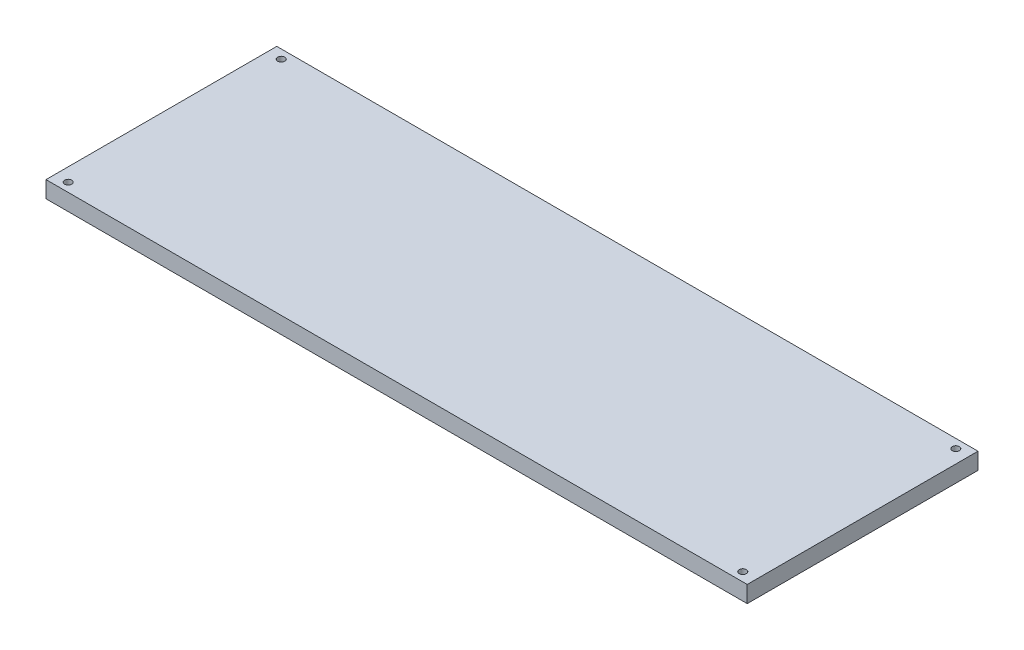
SolidWorks part; units mm, degrees
ref_plane "Front Plane" through (0, 0, 0) normal (0, 0, 1) x (1, 0, 0)
ref_plane "Top Plane" through (0, 0, 0) normal (0, 1, 0) x (1, 0, 0)
ref_plane "Right Plane" through (0, 0, 0) normal (1, 0, 0) x (0, 0, -1)
sketch "Sketch1" plane through (0, 0, 0) normal (0, 1, 0) x (1, 0, 0)
  line L1 (-250.825, -82.55) -> (250.825, -82.55)
  line L2 (-250.825, -82.55) -> (-250.825, 82.55)
  line L3 (-250.825, 82.55) -> (250.825, 82.55)
  line L4 (250.825, -82.55) -> (250.825, 82.55)
  line L5 (-250.825, -82.55) -> (250.825, 82.55) construction
  line L6 (-250.825, 82.55) -> (250.825, -82.55) construction
  point P0 (0, 0)
  dimension "D1" = 501.65
  dimension "D2" = 165.1
extrude "Boss-Extrude1" add sketch "Sketch1" along normal blind 11.9062
hole_wizard "#7 (0.201) Diameter Hole1" positions "Sketch3" profile "Sketch4" hole size "#7" standard "ANSI Inch"
sketch "Sketch3" plane through (0, 11.9062, 0) normal (0, 1, 0) x (1, 0, 0)
  line L0 (250.825, 82.55) -> (-250.825, 82.55) construction
  point P0 (-241.3, 76.2)
  point P12 (241.3, 76.2)
  point P13 (241.3, -76.2)
  point P19 (-241.3, -76.2)
  dimension "D1" = 6.35
  dimension "D2" = 241.3
  dimension "D5" = 152.4
  dimension "D6" = 482.6
  dimension "D3" = 2
  dimension "D4" = 2
sketch "Sketch4" plane through (-241.3, 11.9062, -76.2) normal (1, 0, 0) x (0, 0, 1)
  line L0 (0, 0) -> (0, 11.9062)
  line L1 (0, 11.9062) -> (2.5527, 11.9062)
  line L2 (2.5527, 11.9062) -> (2.5527, 0)
  line L5 (2.5527, 0) -> (0, 0)
  line L11 (0, -6.35) -> (0, 107.95) construction
  dimension "Thru Hole Dia." = 5.1054
  dimension "Thru Hole Depth" = 11.9062
